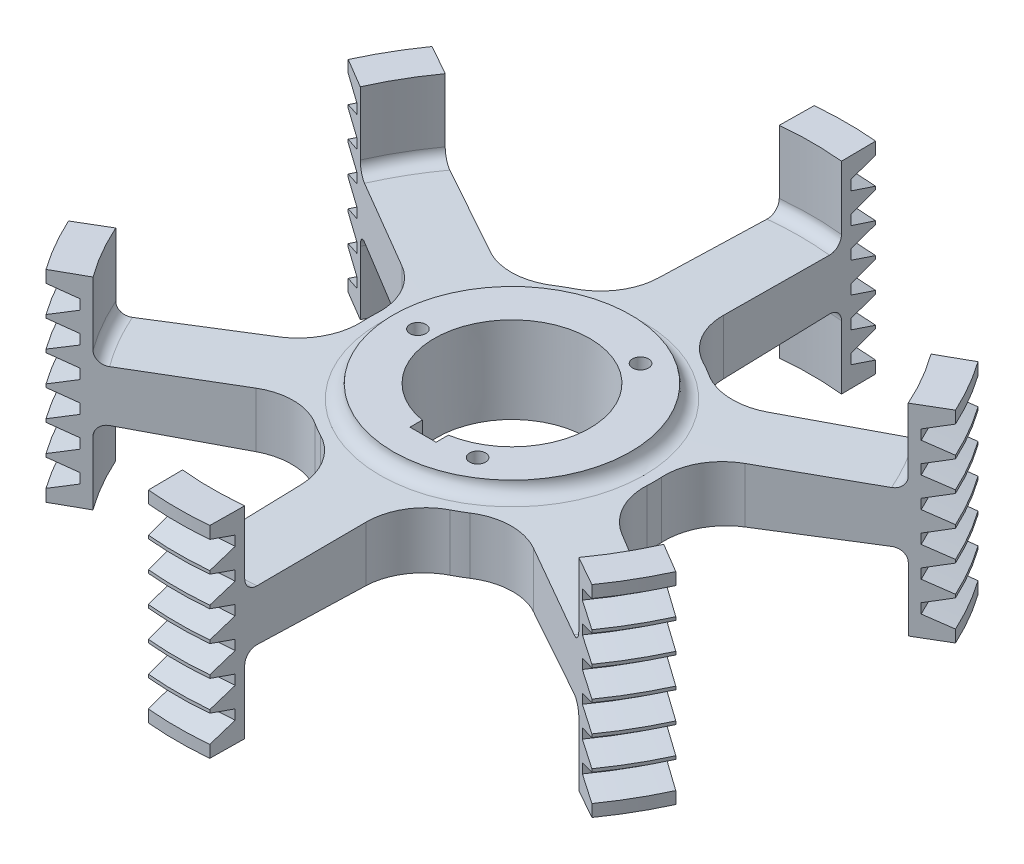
SolidWorks part; units mm, degrees
ref_plane "Front" through (0, 0, 0) normal (0, 0, 1) x (1, 0, 0)
ref_plane "Top" through (0, 0, 0) normal (0, 1, 0) x (1, 0, 0)
ref_plane "Right" through (0, 0, 0) normal (1, 0, 0) x (0, 0, -1)
sketch "Sketch1" plane through (0, 0, 0) normal (0, 0, 1) x (1, 0, 0)
  line L0 (0, 85) -> (0, -85)
  line L1 (281.75, 0.095) -> (0, 0) construction
  line L2 (242.656, -21.4182) -> (111.3008, -23.9668)
  line L3 (0, -35.4663) -> (100.0239, -35.4663)
  line L4 (252.85, -85) -> (252.85, -31.4096)
  line L27 (281.75, -74.8) -> (281.75, -85)
  line L28 (281.75, 1.43) -> (260.75, 8.6609)
  line L29 (281.75, -1.24) -> (260.75, -8.4709)
  line L30 (281.75, -23.98) -> (260.75, -16.7491)
  line L31 (281.75, -26.65) -> (260.75, -33.8809)
  line L32 (281.75, -49.39) -> (260.75, -42.1591)
  line L33 (281.75, -52.06) -> (260.75, -59.2909)
  line L34 (281.75, -74.8) -> (260.75, -67.5691)
  line L35 (281.75, -52.06) -> (281.75, -49.39)
  line L36 (281.75, -26.65) -> (281.75, -23.98)
  line L37 (281.75, -1.24) -> (281.75, 1.43)
  line L38 (260.75, -42.1591) -> (260.75, -33.8809)
  line L39 (260.75, -67.5691) -> (260.75, -59.2909)
  line L40 (260.75, -16.7491) -> (260.75, -8.4709)
  line L41 (281.75, 74.8) -> (260.75, 67.5691)
  line L42 (281.75, 52.06) -> (260.75, 59.2909)
  line L43 (281.75, 49.39) -> (260.75, 42.1591)
  line L44 (281.75, 26.84) -> (260.75, 33.8809)
  line L45 (281.75, 24.17) -> (260.75, 16.9391)
  line L46 (281.75, 24.17) -> (281.75, 26.84)
  line L47 (281.75, 49.39) -> (281.75, 52.06)
  line L48 (281.75, 74.8) -> (281.75, 85)
  line L49 (260.75, 8.6609) -> (260.75, 16.9391)
  line L50 (260.75, 33.8809) -> (260.75, 42.1591)
  line L51 (260.75, 59.2909) -> (260.75, 67.5691)
  line L55 (65.55, 35.5337) -> (63.075, -35.4663)
  line L63 (0, 155.8402) -> (0, -187.0083) construction
  line L65 (0, -85) -> (281.75, -85)
  line L66 (0, 35.5337) -> (100, 35.5337)
  line L67 (0, 85) -> (281.75, 85)
  line L148 (242.6415, 21.5818) -> (111.2847, 24.0419)
  line L149 (252.8288, 85) -> (252.8288, 31.5801)
  arc A0 (100.0239, -35.4663) -> (111.3008, -23.9668) centre (111.5239, -35.4647) cw
  arc A1 (242.656, -21.4182) -> (252.85, -31.4096) centre (242.85, -31.4163) cw
  arc A43 (242.6415, 21.5818) -> (252.8288, 31.5801) centre (242.8288, 31.5801) ccw
  arc A44 (100, 35.5337) -> (111.2847, 24.0419) centre (111.5, 35.5399) ccw
  dimension "D9" = 10
  dimension "D10" = 28.9
  dimension "D13" = 11.5
  dimension "D14" = 48
  dimension "D1" = 563.5
  dimension "D2" = 170
  dimension "D3" = 21
  dimension "D4" = 71
  dimension "D5" = 10.2
  dimension "D6" = 2.67
  dimension "D7" = 38
  dimension "D8" = 22.74
  dimension "D11" = 200
  dimension "D12" = 43
  dimension "D15" = 131.1
  dimension "D16" = 126.15
revolve "Revolve1" add sketch "Sketch1" angle 360 about L63
sketch "Sketch3" plane through (0, 0, 0) normal (0, 1, 0) x (1, 0, 0)
  line L0 (0, 0) -> (0, 657.2252) construction
  line L1 (24.0472, 468.7027) -> (27.1646, 150.9888)
  line L2 (116.7426, 99.1556) -> (394.1134, 254.6769)
  line L3 (0, 0) -> (731.9638, 0) construction
  line L4 (0, 0) -> (632.5097, 365.1797) construction
  arc A0 (408.5716, 329.6881) -> (81.839, 518.5821) centre (0, 0) ccw
  arc A1 (65.1454, 100.7774) -> (54.4674, 106.9266) centre (0, 0) ccw
  arc A2 (24.0472, 468.7027) -> (81.839, 518.5821) centre (74.0448, 469.1933) cw
  arc A3 (27.1646, 150.9888) -> (54.4674, 106.9266) centre (77.1622, 151.4794) ccw
  arc A4 (116.7426, 99.1556) -> (65.1454, 100.7774) centre (92.2893, 142.768) cw
  arc A5 (394.1134, 254.6769) -> (408.5716, 329.6881) centre (369.66, 298.2892) ccw
  point P11 (23.5, 524.4738)
  point P14 (27.5, 116.8065)
  dimension "D1" = 1050
  dimension "D2" = 240
  dimension "D6" = 50
  dimension "D3" = 23.5
  dimension "D4" = 23.5
  dimension "D5" = 27.5
  dimension "D7" = 30
  dimension "D8" = 27.5
extrude "Cut-Extrude1" cut sketch "Sketch3" against normal through all and the other way through all
pattern_circular "CirPattern1" count 6 over 360 about axis through (0, 0, 0) along (0, 1, 0) of "Cut-Extrude1"
sketch "Sketch6" plane through (0, 0, 0) normal (0, 1, 0) x (1, 0, 0)
  line L0 (0, 0) -> (0, -132.8686) construction
  line L1 (-11, -48.1978) -> (-11, -75)
  line L2 (11, -48.1978) -> (11, -75)
  line L3 (-11, -75) -> (11, -75)
  point P9 (0, -75)
  dimension "D1" = 22
  dimension "D2" = 75
extrude "Cut-Extrude2" cut sketch "Sketch6" against normal through all and the other way through all flip side to cut
hole_wizard "5/8-11 Tapped Hole1" positions "Sketch8" profile "Sketch7" tap size "5/8-11" standard "Ansi Inch"
sketch "Sketch8" plane through (0, 35.5337, 0) normal (0, 1, 0) x (-1, 0, 0)
  circle A0 centre (0, 0) radius 79.3 construction
  point P0 (79.3, 0)
  dimension "D1" = 158.6
sketch "Sketch7" plane through (-79.3, 35.5337, 0) normal (1, 0, 0) x (0, 0, 1)
  line L0 (0, 0) -> (0, 39.0535)
  line L1 (0, 39.0535) -> (6.7462, 35)
  line L2 (6.7462, 35) -> (6.7462, 0)
  line L5 (6.7462, 0) -> (0, 0)
  line L10 (0, 39.0535) -> (-6.7462, 35) construction
  line L11 (0, -6.35) -> (0, 107.95) construction
  dimension "Tap Drill Dia." = 13.4925
  dimension "Tap Drill Depth" = 35
  dimension "Drill Angle" = 118
pattern_circular "CirPattern2" count 3 over 360 about axis through (0, 0, 0) along (0, 1, 0) of "5/8-11 Tapped Hole1"
sketch "Sketch10" [suppressed] plane through (0, 0, 0) normal (1, 0, 0) x (0, 0, -1)
  line L1 (-392.978, 218.6171) -> (385.0619, 218.6171)
  line L2 (-392.978, 218.6171) -> (-392.978, -347.8478)
  line L3 (-392.978, -347.8478) -> (385.0619, -347.8478)
  line L4 (385.0619, 218.6171) -> (385.0619, -347.8478)
extrude "Extrude2" [suppressed] cut sketch "Sketch10" against normal through all
sketch "Sketch11" [suppressed] plane through (0, 0, 0) normal (-1, 0, 0) x (0, 0, 1)
  line L0 (252.85, -31.4096) -> (252.85, -85) construction
  line L1 (0, 0) -> (0, -49.39) construction
  line L2 (252.8288, 31.5801) -> (252.8288, 85) construction
  line L3 (252.85, -31.4096) -> (252.85, -85)
  line L4 (252.8288, 31.5801) -> (252.8288, 85)
  line L5 (252.85, -31.4096) -> (252.8288, 31.5801)
  line L34 (111.3008, -23.9668) -> (242.656, -21.4182)
  line L35 (252.85, -31.4163) -> (252.85, -85)
  line L36 (252.85, -85) -> (281.75, -85)
  line L37 (281.75, -85) -> (281.75, -74.8)
  line L38 (281.75, -74.8) -> (260.75, -67.5691)
  line L39 (260.75, -67.5691) -> (260.75, -59.2909)
  line L40 (260.75, -59.2909) -> (281.75, -52.06)
  line L41 (281.75, -52.06) -> (281.75, -49.39)
  line L42 (281.75, -49.39) -> (260.75, -42.1591)
  line L43 (260.75, -42.1591) -> (260.75, -33.8809)
  line L44 (260.75, -33.8809) -> (281.75, -26.65)
  line L45 (281.75, -26.65) -> (281.75, -23.98)
  line L46 (281.75, -23.98) -> (260.75, -16.7491)
  line L47 (260.75, -16.7491) -> (260.75, -8.4709)
  line L48 (260.75, -8.4709) -> (281.75, -1.24)
  line L49 (281.75, -1.24) -> (281.75, 1.43)
  line L50 (281.75, 1.43) -> (260.75, 8.6609)
  line L51 (260.75, 8.6609) -> (260.75, 16.9391)
  line L52 (260.75, 16.9391) -> (281.75, 24.17)
  line L53 (281.75, 24.17) -> (281.75, 26.84)
  line L54 (281.75, 26.84) -> (260.75, 33.8809)
  line L55 (260.75, 33.8809) -> (260.75, 42.1591)
  line L56 (260.75, 42.1591) -> (281.75, 49.39)
  line L57 (281.75, 49.39) -> (281.75, 52.06)
  line L58 (281.75, 52.06) -> (260.75, 59.2909)
  line L59 (260.75, 59.2909) -> (260.75, 67.5691)
  line L60 (260.75, 67.5691) -> (281.75, 74.8)
  line L61 (281.75, 74.8) -> (281.75, 85)
  line L62 (281.75, 85) -> (252.8288, 85)
  line L63 (252.8288, 85) -> (252.8288, 31.5801)
  line L64 (242.6415, 21.5818) -> (111.2847, 24.0419)
  line L65 (100, 35.5337) -> (75, 35.5337)
  line L66 (75, 35.5337) -> (75, -35.4663)
  line L67 (75, -35.4663) -> (100.0239, -35.4663)
  line L70 (252.85, -85) -> (281.75, -85)
  line L71 (281.75, -85) -> (281.75, -74.8)
  line L72 (281.75, -74.8) -> (260.75, -67.5691)
  line L73 (260.75, -67.5691) -> (260.75, -59.2909)
  line L74 (260.75, -59.2909) -> (281.75, -52.06)
  line L75 (281.75, -52.06) -> (281.75, -49.39)
  line L76 (281.75, -49.39) -> (260.75, -42.1591)
  line L77 (260.75, -42.1591) -> (260.75, -33.8809)
  line L78 (260.75, -33.8809) -> (281.75, -26.65)
  line L79 (281.75, -26.65) -> (281.75, -23.98)
  line L80 (281.75, -23.98) -> (260.75, -16.7491)
  line L81 (260.75, -16.7491) -> (260.75, -8.4709)
  line L82 (260.75, -8.4709) -> (281.75, -1.24)
  line L83 (281.75, -1.24) -> (281.75, 1.43)
  line L84 (281.75, 1.43) -> (260.75, 8.6609)
  line L85 (260.75, 8.6609) -> (260.75, 16.9391)
  line L86 (260.75, 16.9391) -> (281.75, 24.17)
  line L87 (281.75, 24.17) -> (281.75, 26.84)
  line L88 (281.75, 26.84) -> (260.75, 33.8809)
  line L89 (260.75, 33.8809) -> (260.75, 42.1591)
  line L90 (260.75, 42.1591) -> (281.75, 49.39)
  line L91 (281.75, 49.39) -> (281.75, 52.06)
  line L92 (281.75, 52.06) -> (260.75, 59.2909)
  line L93 (260.75, 59.2909) -> (260.75, 67.5691)
  line L94 (260.75, 67.5691) -> (281.75, 74.8)
  line L95 (281.75, 74.8) -> (281.75, 85)
  line L96 (281.75, 85) -> (252.8288, 85)
  arc A4 (252.85, -31.4163) -> (242.656, -21.4182) centre (242.85, -31.4163) ccw
  arc A5 (242.6415, 21.5818) -> (252.8288, 31.5801) centre (242.8288, 31.5801) ccw
  arc A6 (100, 35.5337) -> (111.2847, 24.0419) centre (111.5, 35.5399) ccw
  arc A7 (111.3008, -23.9668) -> (100.0239, -35.4663) centre (111.5239, -35.4647) ccw
  dimension "D1" = 0
revolve "Revolve3" [suppressed] add sketch "Sketch11" angle 180 about L1
mirror "Mirror1" [suppressed] about plane through (0, 0, 0) normal (1, 0, 0)
scale "Scale1" scale about centroid uniform scaling yes scale factor 0.030511
scale "Scale2" [suppressed]
